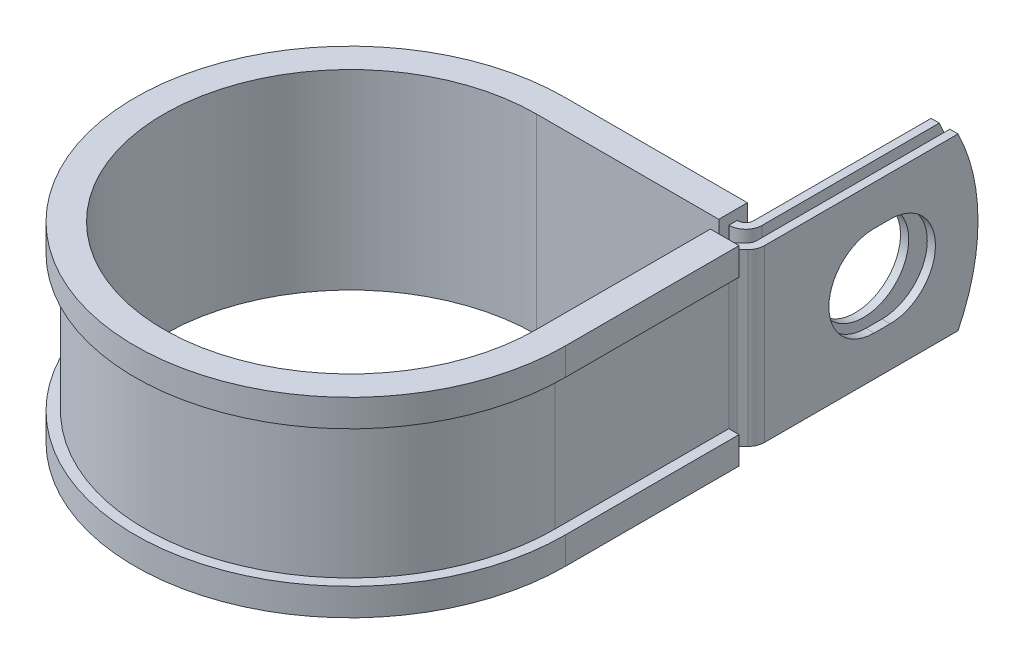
SolidWorks part; units mm, degrees
ref_plane "Front Plane" through (0, 0, 0) normal (0, 0, 1) x (1, 0, 0)
ref_plane "Top Plane" through (0, 0, 0) normal (0, 1, 0) x (1, 0, 0)
ref_plane "Right Plane" through (0, 0, 0) normal (1, 0, 0) x (0, 0, -1)
sketch "Sketch1" plane through (0, 0, 0) normal (0, 1, 0) x (1, 0, 0)
  line L0 (0, 29.2989) -> (27.1832, 29.2989)
  line L1 (29.2989, 0) -> (29.2989, 25.8864)
  line L2 (29.6216, 61.1124) -> (29.6216, 31.7373)
  line L3 (30.0131, 27.6106) -> (30.8393, 28.4368)
  line L5 (31.1964, 29.2989) -> (31.1964, 61.1124)
  arc A0 (0, 29.2989) -> (29.2989, 0) centre (0, 0) ccw
  arc A1 (30.0131, 27.6106) -> (29.2989, 25.8864) centre (31.7373, 25.8864) ccw
  arc A2 (30.8393, 28.4368) -> (31.1964, 29.2989) centre (29.9772, 29.2989) ccw
  arc A3 (27.1832, 29.2989) -> (29.6216, 31.7373) centre (27.1832, 31.7373) ccw
extrude "Extrude-Thin1" add sketch "Sketch1" along normal mid plane 25.4 thin
sketch "Sketch2" plane through (28.4024, 0, 0) normal (-1, 0, 0) x (0, 0, 1)
  line L0 (-61.1124, 12.7) -> (-61.1124, -12.7) construction
  line L1 (0, 12.7) -> (0, -12.7) construction
  circle A0 centre (-46.8376, 0) radius 6.7437
  point P2 (-61.1124, 0)
extrude "Cut-Extrude1" cut sketch "Sketch2" against normal up to surface (1.2192 mm away)
sketch "Sketch3" plane through (32.4156, 0, 0) normal (1, 0, 0) x (0, 0, -1)
  line L0 (45.6438, 0) -> (48.0314, 0) construction
  line L1 (45.6438, 6.7437) -> (48.0314, 6.7437)
  line L2 (45.6438, -6.7437) -> (48.0314, -6.7437)
  line L3 (61.1124, 12.7) -> (61.1124, -12.7) construction
  arc A0 (45.6438, 6.7437) -> (45.6438, -6.7437) centre (45.6438, 0) ccw
  arc A1 (48.0314, -6.7437) -> (48.0314, 6.7437) centre (48.0314, 0) ccw
  point P3 (46.8376, 0)
  point P8 (61.1124, 0)
  point P11 (38.9001, 0)
  point P12 (54.7751, 0)
extrude "Cut-Extrude2" cut sketch "Sketch3" against normal up to surface (1.2192 mm away)
sketch "Sketch4" plane through (28.4024, 0, 0) normal (-1, 0, 0) x (0, 0, 1)
  line L0 (-61.1124, 12.7) -> (-61.1124, -12.7)
  line L1 (-61.1124, 12.7) -> (-58.1351, 12.7)
  line L2 (-61.1124, 12.7) -> (-31.7373, 12.7) construction
  line L3 (-61.1124, -12.7) -> (-58.1351, -12.7)
  line L4 (-61.1124, -12.7) -> (-31.7373, -12.7) construction
  arc A0 (-58.1351, 12.7) -> (-58.1351, -12.7) centre (-32.5374, 0) ccw
extrude "Cut-Extrude3" cut sketch "Sketch4" against normal through all contours A0 M4 M5 | A0 L0 M2
ref_plane "Plane1" through (0, 0, -25.8864) normal (0, 0, -1) x (-1, 0, 0)
ref_plane "Plane2" through (27.1324, 0, 0) normal (-1, 0, 0) x (0, 0, 1)
sketch "Sketch5" plane through (0, 0, -25.8864) normal (0, 0, -1) x (-1, 0, 0)
  line L0 (-30.5181, 12.7) -> (-29.2989, 12.7)
  line L1 (-30.5181, 12.7) -> (-30.5181, -12.7) construction
  line L3 (-29.2989, 12.7) -> (-29.2989, -12.7)
  line L4 (-29.2989, -12.7) -> (-30.5181, -12.7)
  line L5 (-30.5181, -12.7) -> (-30.5181, -10.16)
  line L6 (-30.5181, 12.7) -> (-30.5181, 10.16)
  line L7 (-32.0421, 14.224) -> (-32.0421, 10.16)
  line L8 (-32.0421, 14.224) -> (-27.7749, 14.224)
  line L9 (-27.7749, 14.224) -> (-27.7749, -14.224)
  line L10 (-27.7749, -14.224) -> (-32.0421, -14.224)
  line L11 (-32.0421, -14.224) -> (-32.0421, -10.16)
  line L12 (-32.0421, 10.16) -> (-30.5181, 10.16)
  line L13 (-30.5181, -10.16) -> (-32.0421, -10.16)
sketch "Sketch6" plane through (0, 12.7, 0) normal (0, 1, 0) x (1, 0, 0)
  line L0 (27.7749, 0) -> (27.7749, 25.8864)
  line L1 (27.7749, 25.8864) -> (32.0421, 25.8864) construction
  line L2 (27.1324, 6.9878) -> (27.1324, -6.9878) construction
  line L5 (0, 27.7749) -> (27.1324, 27.7749)
  arc A0 (0, 27.7749) -> (27.7749, 0) centre (0, 0) ccw
sweep "Sweep1" add profiles "Sketch5" path "Sketch6"
equation "\"D4@Sketch5\" = \"D1@Extrude-Thin1\""
equation "\"D5@Sketch5\" = \"D5@Extrude-Thin1\""
equation "\"D1@Sketch3\" = \"D2@Sketch2\""
equation "\"D7@Sketch1\" = \"D3@Sketch2\" + \"D1@Sketch3\""
equation "\"D1@Sketch1\" = \"D1@Sketch6\" + 2 * \"D3@Sketch5\""
equation "\"D1@Sketch4\" = ( \"D1@Extrude-Thin1\" + .125 ) * 2"
equation "\"D9@Sketch1\"= \"D5@Extrude-Thin1\""
equation "\"D8@Sketch1\"= 2 * \"D5@Extrude-Thin1\""
equation "\"D2@Sketch1\" = 2 * \"D5@Extrude-Thin1\""
equation "\"D2@Sketch3\" = \"D1@Sketch2\""
